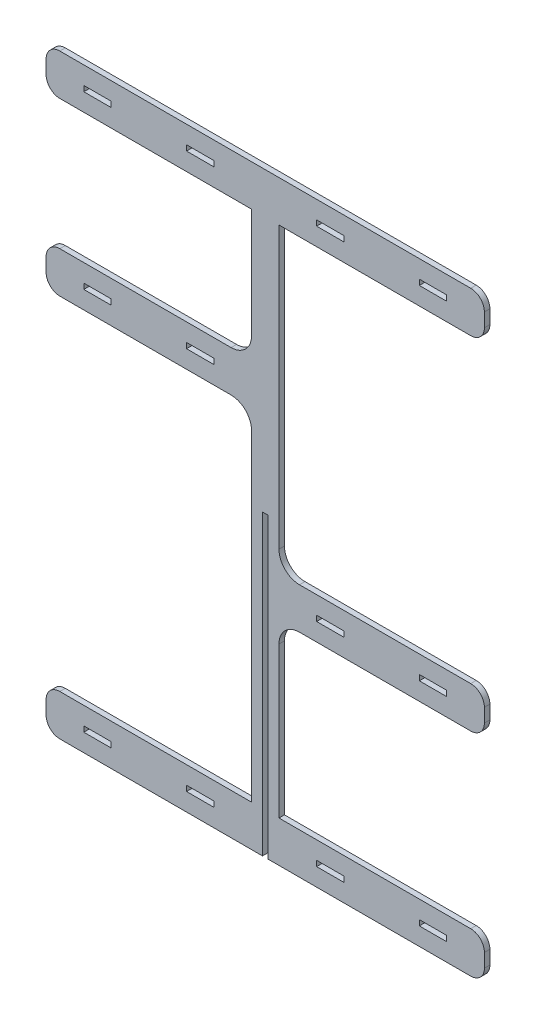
SolidWorks part; units mm, degrees
ref_plane "Alzado" through (0, 0, 0) normal (0, 0, 1) x (1, 0, 0)
ref_plane "Planta" through (0, 0, 0) normal (0, 1, 0) x (1, 0, 0)
ref_plane "Vista lateral" through (0, 0, 0) normal (1, 0, 0) x (0, 0, -1)
sketch "Croquis1" plane through (0, 0, 0) normal (0, 0, 1) x (1, 0, 0)
  line L0 (0, 0) -> (0, 30)
  line L1 (0, 30) -> (320, 30)
  line L2 (320, 30) -> (320, 0)
  line L3 (320, 0) -> (0, 0)
  line L4 (160, 0) -> (160, 30) construction
  line L5 (150, 30) -> (150, 0) construction
  line L6 (0, 15) -> (150, 15) construction
  line L7 (75, 0) -> (75, 30) construction
  line L8 (27.5, 13) -> (47.5, 13)
  line L9 (27.5, 13) -> (27.5, 17)
  line L10 (27.5, 17) -> (47.5, 17)
  line L11 (47.5, 13) -> (47.5, 17)
  line L12 (27.5, 13) -> (47.5, 17) construction
  line L13 (27.5, 17) -> (47.5, 13) construction
  line L14 (102.5, 13) -> (122.5, 13)
  line L15 (102.5, 13) -> (102.5, 17)
  line L16 (102.5, 17) -> (122.5, 17)
  line L17 (122.5, 13) -> (122.5, 17)
  line L18 (102.5, 13) -> (122.5, 17) construction
  line L19 (102.5, 17) -> (122.5, 13) construction
  line L20 (217.5, 17) -> (197.5, 17)
  line L21 (197.5, 13) -> (197.5, 17)
  line L22 (217.5, 13) -> (197.5, 13)
  line L23 (217.5, 13) -> (217.5, 17)
  line L24 (292.5, 17) -> (272.5, 17)
  line L25 (272.5, 13) -> (272.5, 17)
  line L26 (292.5, 13) -> (272.5, 13)
  line L27 (292.5, 13) -> (292.5, 17)
  point P11 (37.5, 15)
  point P16 (112.5, 15)
extrude "Saliente-Extruir1" add sketch "Croquis1" along normal mid plane 4
sketch "Croquis2" plane through (0, 0, 0) normal (0, 0, 1) x (1, 0, 0)
  line L0 (160, 30) -> (160, 435) construction
  line L1 (320, 30) -> (0, 30) construction
  line L2 (170, 30) -> (170, 140)
  line L3 (185, 155) -> (320, 155)
  line L4 (320, 155) -> (320, 185)
  line L5 (320, 185) -> (185, 185)
  line L6 (170, 200) -> (170, 435)
  line L7 (170, 435) -> (150, 435)
  line L8 (150, 435) -> (150, 325)
  line L9 (135, 310) -> (0, 310)
  line L10 (0, 310) -> (0, 280)
  line L11 (0, 280) -> (135, 280)
  line L12 (150, 265) -> (150, 30)
  line L13 (150, 30) -> (170, 30)
  line L14 (0, 295) -> (150, 295) construction
  line L15 (102.5, 293) -> (102.5, 297)
  line L16 (27.5, 293) -> (47.5, 293)
  line L17 (27.5, 293) -> (27.5, 297)
  line L18 (27.5, 297) -> (47.5, 297)
  line L19 (47.5, 293) -> (47.5, 297)
  line L20 (27.5, 293) -> (47.5, 297) construction
  line L21 (27.5, 297) -> (47.5, 293) construction
  line L22 (102.5, 293) -> (122.5, 293)
  line L23 (122.5, 293) -> (122.5, 297)
  line L24 (102.5, 297) -> (122.5, 297)
  line L25 (320, 170) -> (170, 170) construction
  line L27 (272.5, 168) -> (292.5, 168)
  line L28 (272.5, 168) -> (272.5, 172)
  line L29 (272.5, 172) -> (292.5, 172)
  line L30 (292.5, 168) -> (292.5, 172)
  line L31 (272.5, 168) -> (292.5, 172) construction
  line L32 (272.5, 172) -> (292.5, 168) construction
  line L33 (197.5, 168) -> (217.5, 168)
  line L34 (197.5, 168) -> (197.5, 172)
  line L35 (197.5, 172) -> (217.5, 172)
  line L36 (217.5, 168) -> (217.5, 172)
  line L37 (197.5, 168) -> (217.5, 172) construction
  line L38 (197.5, 172) -> (217.5, 168) construction
  arc A0 (170, 140) -> (185, 155) centre (185, 140) cw
  arc A1 (185, 185) -> (170, 200) centre (185, 200) cw
  arc A2 (135, 280) -> (150, 265) centre (135, 265) cw
  arc A3 (150, 325) -> (135, 310) centre (135, 325) cw
  point P21 (37.5, 295)
  point P30 (207.5, 170)
  point P31 (282.5, 170)
  point P41 (170, 155)
  point P44 (170, 185)
  point P47 (150, 280)
extrude "Saliente-Extruir2" add sketch "Croquis2" along normal mid plane 4
fillet "Redondeo1" radius 10 4 edges at (320, 155, 0) (320, 185, 0) (0, 280, 0) (0, 310, 0)
fillet "Redondeo2" radius 10 4 edges at (320, 0, 0) (320, 30, 0) (0, 0, 0) (0, 30, 0)
pattern_linear "MatrizL1" [suppressed] count 1 spacing 280
pattern_linear "MatrizL2" count 2 spacing 405 along (0, 1, 0) of "Saliente-Extruir1", "Redondeo2"
sketch "Croquis3" plane through (0, 0, 0) normal (0, 0, 1) x (1, 0, 0)
  line L0 (10, 0) -> (310, 0) construction
  line L1 (158, 0) -> (162, 0)
  line L2 (158, 0) -> (158, 217.5)
  line L3 (158, 217.5) -> (162, 217.5)
  line L4 (162, 0) -> (162, 217.5)
  point P4 (160, 0)
  point P5 (160, 0)
extrude "Cortar-Extruir1" cut sketch "Croquis3" against normal through all both and the other way through all
equation "\"D1@Croquis1\"=\"supportWidth\""
equation "\"D2@Croquis1\"=\"holderWidth\"/2"
equation "\"D3@Croquis1\"=\"shelfRadius\""
equation "\"D4@Croquis1\"=\"thickness\""
equation "\"D5@Croquis1\"=\"tabSlotLength\""
equation "\"D6@Croquis1\"=\"shelfRadius\"/2"
equation "\"D7@Croquis1\"=\"shelfRadius\"/4"
equation "\"D1@Saliente-Extruir1\"=\"thickness\""
equation "\"D1@Croquis2\"=\"holderWidth\""
equation "\"D2@Croquis2\"=\"shelfRadius\""
equation "\"D3@Croquis2\"=\"shelfSpacing\""
equation "\"D4@Croquis2\"=\"shelfSpacing\"/2"
equation "\"D5@Croquis2\"=\"supportWidth\""
equation "\"D6@Croquis2\"=\"shelfRadius\"/4"
equation "\"D7@Croquis2\"=\"thickness\""
equation "\"D8@Croquis2\"=\"tabSlotLength\""
equation "\"D10@Croquis2\"=\"shelfRadius\"/2"
equation "\"D11@Croquis2\"=\"shelfRadius\"/2"
equation "\"D12@Croquis2\"=\"shelfRadius\"/4"
equation "\"D3@MatrizL1\"=\"shelfSpacing\"+\"supportWidth\""
equation "\"D1@MatrizL1\"=\"totalShelves\""
equation "\"D3@MatrizL2\"=(\"shelfSpacing\"+\"supportWidth\")*\"totalShelves\"+\"shelfSpacing\"/2"
equation "\"MatrizL1\"= IIF ( \"totalShelves\" > 1 , 0 , 1 )"
equation "\"totalShelves\" = 1'Numero de estantes"
equation "\"shelfSpacing\"= 25cm'Distancia entre estantes"
equation "\"thickness\"= 4mm'Espesor del material"
equation "\"shelfRadius\"= 15cm'Radio de la repisa "
equation "\"supportWidth\"= 3cm'ancho del soporte"
equation "\"holderWidth\"= 2cm'ancho de la estructura"
equation "\"tabSlotLength\"= 20mm'Largo de las pestañas "
equation "\"totalHeight\"= ( \"shelfSpacing\" * \"totalShelves\" ) + ( \"shelfSpacing\" * 0.5 ) + \"supportWidth\" * ( \"totalShelves\" + 1 )'Altura total"
equation "\"D1@Croquis3\"=\"thickness\""
equation "\"D2@Croquis3\"=\"totalHeight\"/2"
equation "\"D13@Croquis2\"=\"supportWidth\"/2"
